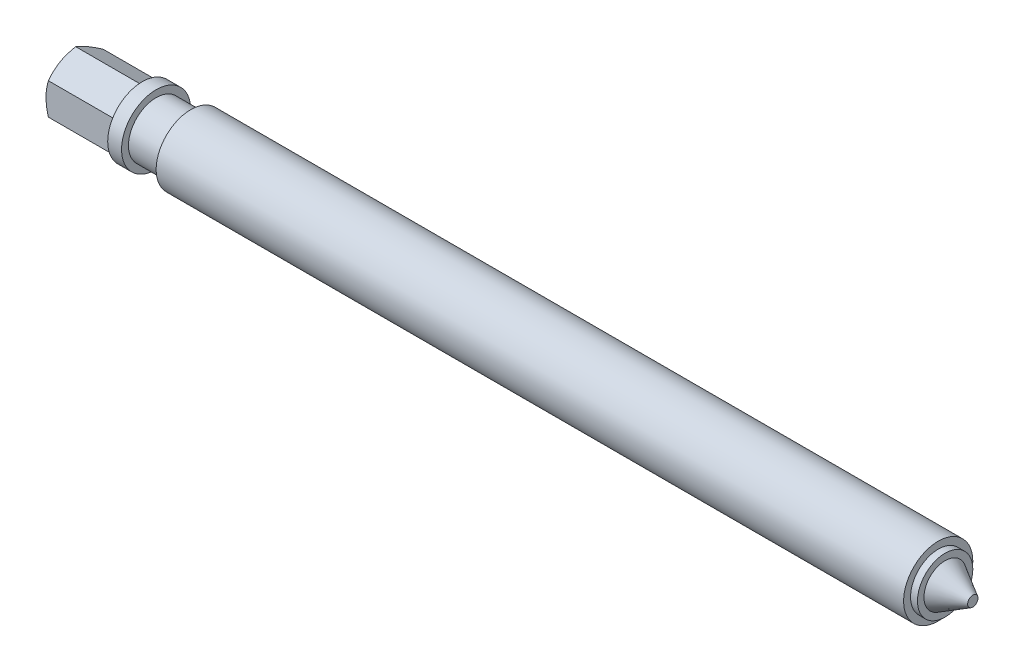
SolidWorks part; units mm, degrees
ref_plane "Vorne" through (0, 0, 0) normal (0, 0, 1) x (1, 0, 0)
ref_plane "Oben" through (0, 0, 0) normal (0, 1, 0) x (1, 0, 0)
ref_plane "Rechts" through (0, 0, 0) normal (1, 0, 0) x (0, 0, -1)
sketch "Skizze1" plane through (0, 0, 0) normal (0, 0, 1) x (1, 0, 0)
  line L0 (0, 0) -> (-136.7334, 0) construction
  line L1 (0, 0) -> (0, 0.75)
  line L2 (0, 0.75) -> (-4, 3.0594)
  line L3 (-4, 3.0594) -> (-4, 4)
  line L4 (-5, 5) -> (-130, 5)
  line L5 (-130, 0) -> (-130, 5)
  line L6 (0, 0) -> (-130, 0)
  line L7 (-4, 4) -> (-5, 4)
  line L8 (-5, 4) -> (-5, 5)
  dimension "D1" = 130
  dimension "D2" = 10
  dimension "D3" = 30
  dimension "D4" = 1.5
  dimension "D5" = 4
  dimension "D6" = 5
  dimension "D7" = 4
revolve "Rotation1" add sketch "Skizze1" angle 360 about L0
sketch "Skizze2" plane through (-130, 0, 0) normal (-1, 0, 0) x (0, 0, 1)
  line L1 (3.95, 2.2805) -> (0, 4.5611)
  line L2 (0, 4.5611) -> (-3.95, 2.2805)
  line L3 (-3.95, 2.2805) -> (-3.95, -2.2805)
  line L4 (-3.95, -2.2805) -> (0, -4.5611)
  line L5 (0, -4.5611) -> (3.95, -2.2805)
  line L6 (3.95, -2.2805) -> (3.95, 2.2805)
  circle A0 centre (0, 0) radius 3.95 construction
  dimension "D1" = 7.9
extrude "Schnitt-Linear austragen1" cut sketch "Skizze2" against normal blind 10 flip side to cut
sketch "Skizze3" plane through (0, 0, 0) normal (0, 0, 1) x (1, 0, 0)
  line L0 (0, 0) -> (-130, 0) construction
  line L1 (-130, -2.2805) -> (-130, 2.2805) construction
  line L3 (-118, 5) -> (-113, 5)
  line L4 (-118, 5) -> (-118, 4)
  line L5 (-118, 4) -> (-113, 4)
  line L6 (-113, 5) -> (-113, 4)
  line L7 (-120, 2.2805) -> (-120, 4.5611) construction
  line L8 (-5, 5) -> (-120, 5) construction
  dimension "D1" = 2
  dimension "D2" = 5
  dimension "D3" = 8
revolve "Schnitt-Rotation1" cut sketch "Skizze3" angle 360 about L0
sketch "Skizze4" plane through (0, 0, 0) normal (0, 0, 1) x (1, 0, 0)
  line L0 (0, 0) -> (-130, 0) construction
  line L1 (-130, -2.2805) -> (-130, 2.2805) construction
  line L2 (-130, 3.9) -> (-129.6183, 4.5611)
  line L3 (-130, 2.2805) -> (-130, 4.5611) construction
  line L4 (-120, 4.5611) -> (-130, 4.5611) construction
  line L5 (-129.6183, 4.5611) -> (-130, 4.5611)
  line L6 (-130, 4.5611) -> (-130, 3.9)
  dimension "D1" = 30
  dimension "D2" = 7.8
revolve "Schnitt-Rotation2" cut sketch "Skizze4" angle 360 about L0
